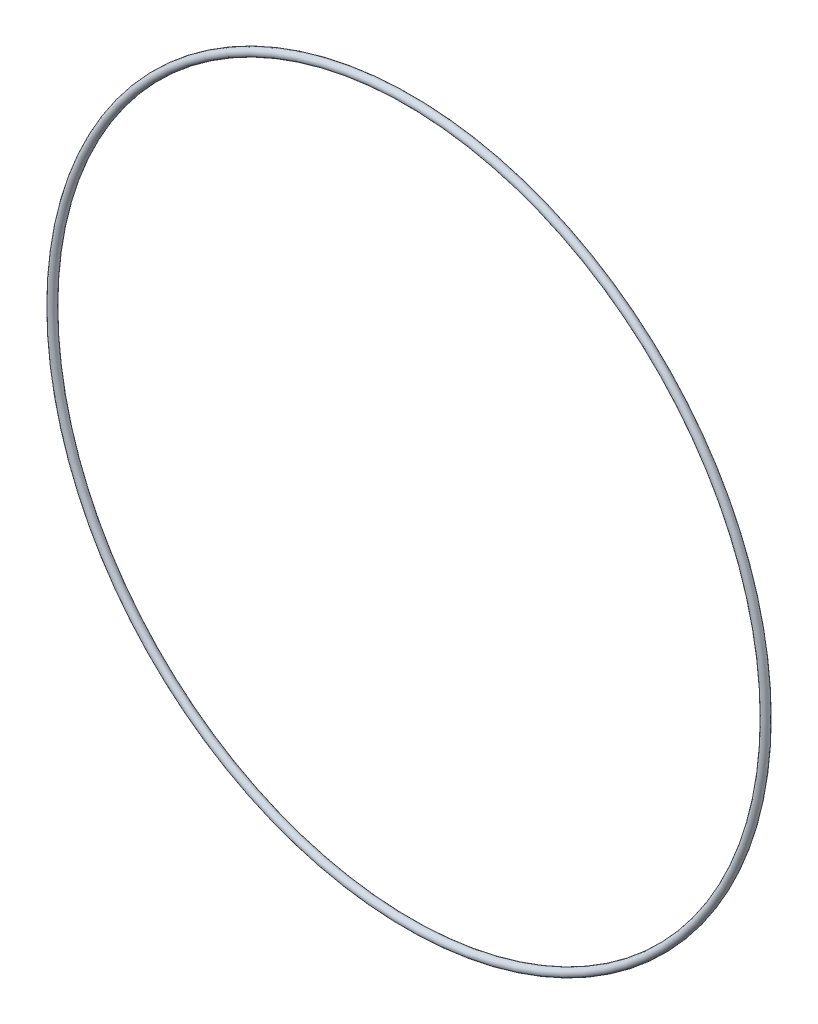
SolidWorks part; units mm, degrees
ref_plane "Front" through (0, 0, 0) normal (0, 0, 1) x (1, 0, 0)
ref_plane "Top" through (0, 0, 0) normal (0, 1, 0) x (1, 0, 0)
ref_plane "Right" through (0, 0, 0) normal (1, 0, 0) x (0, 0, -1)
sketch "Sketch1" plane through (0, 0, 0) normal (1, 0, 0) x (0, -1, 0)
  line L0 (0, -2.667) -> (0, 2.667) construction
  line L2 (-270.6687, 0) -> (270.6687, 0) construction
  line L3 (-240.7285, 0) -> (240.7285, 0) construction
  circle A0 centre (243.3955, 0) radius 2.667
  point P9 (240.7285, 0)
  point P10 (246.0625, 0)
  point P13 (243.3955, 2.667)
  point P14 (243.3955, -2.667)
  dimension "Width" = 5.334
  dimension "ID" = 481.457
revolve "Revolve1" add sketch "Sketch1" angle 360 about L0
